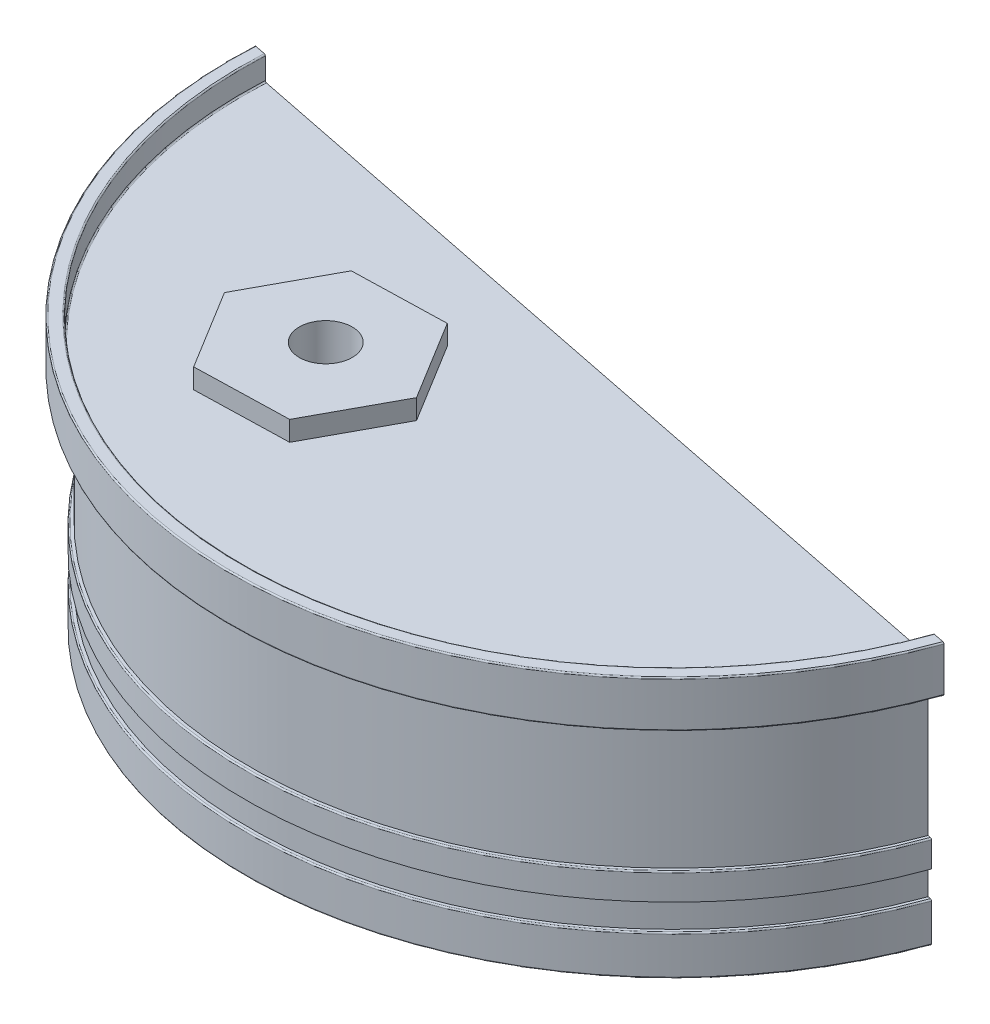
SolidWorks part; units mm, degrees
ref_plane "Plan de face" through (0, 0, 0) normal (0, 0, 1) x (1, 0, 0)
ref_plane "Plan de dessus" through (0, 0, 0) normal (0, 1, 0) x (1, 0, 0)
ref_plane "Plan de droite" through (0, 0, 0) normal (1, 0, 0) x (0, 0, -1)
sketch "Esquisse1" plane through (0, 0, 0) normal (0, 0, 1) x (1, 0, 0)
  line L0 (-325, 0) -> (-325, 18)
  line L1 (-325, 18) -> (-335, 18)
  line L2 (-335, 18) -> (-335, -17)
  line L3 (-335, -17) -> (-320, -17)
  line L4 (-320, -17) -> (-320, -117)
  line L5 (-320, -117) -> (-323.1785, -117)
  line L6 (-323.1785, -117) -> (-323.1785, -137)
  line L7 (-323.1785, -137) -> (-320, -137)
  line L8 (-320, -137) -> (-320, -157)
  line L9 (-320, -157) -> (-323.1785, -157)
  line L10 (-323.1785, -157) -> (-323.1785, -187)
  line L11 (-323.1785, -187) -> (0, -187)
  line L12 (0, -187) -> (0, 0)
  line L13 (0, 0) -> (-325, 0)
  line L14 (0, 62.5446) -> (0, -59.3875) construction
  dimension "D1" = 325
  dimension "D2" = 335
  dimension "D3" = 35
  dimension "D4" = 18
  dimension "D5" = 320
  dimension "D6" = 100
  dimension "D7" = 20
  dimension "D8" = 20
  dimension "D9" = 30
revolve "Révolution1" add sketch "Esquisse1" angle 360 about L14
fillet "Congé1" radius 1 8 edges at (0, -187, 323.1785) (0, -157, 323.1785) (0, -117, 323.1785) (0, -17, 320) (0, -17, 335) (0, 18, 335) (0, 0, 325) (0, 18, 325)
sketch "Esquisse2" plane through (0, 0, 0) normal (0, 1, 0) x (-1, 0, 0)
  line L1 (79.893, 209.8492) -> (46.2628, 147.7961)
  line L2 (46.2628, 147.7961) -> (83.1872, 87.645)
  line L3 (83.1872, 87.645) -> (153.7419, 89.547)
  line L4 (153.7419, 89.547) -> (187.372, 151.6)
  line L5 (187.372, 151.6) -> (150.4476, 211.7511)
  line L6 (150.4476, 211.7511) -> (79.893, 209.8492)
extrude "Extrusion1" add sketch "Esquisse2" along normal blind 15
sketch "Esquisse3" plane through (0, 15, 0) normal (0, 1, 0) x (-1, 0, 0)
  circle A0 centre (116.7143, 145.8313) radius 20
  dimension "D1" = 40
extrude "Enlèv. mat.-Extru.1" cut sketch "Esquisse3" against normal blind 30
sketch "Esquisse4" plane through (0, 0, 0) normal (0, 1, 0) x (-1, 0, 0)
  line L0 (-357.9289, 120.3022) -> (367.4578, -25.0133)
  line L1 (367.4578, -25.0133) -> (340.0622, -475.2533)
  line L2 (340.0622, -475.2533) -> (-357.9289, -369.2444)
  line L3 (-357.9289, -369.2444) -> (-357.9289, 120.3022)
extrude "Enlèv. mat.-Extru.2" cut sketch "Esquisse4" against normal through all and the other way through all
